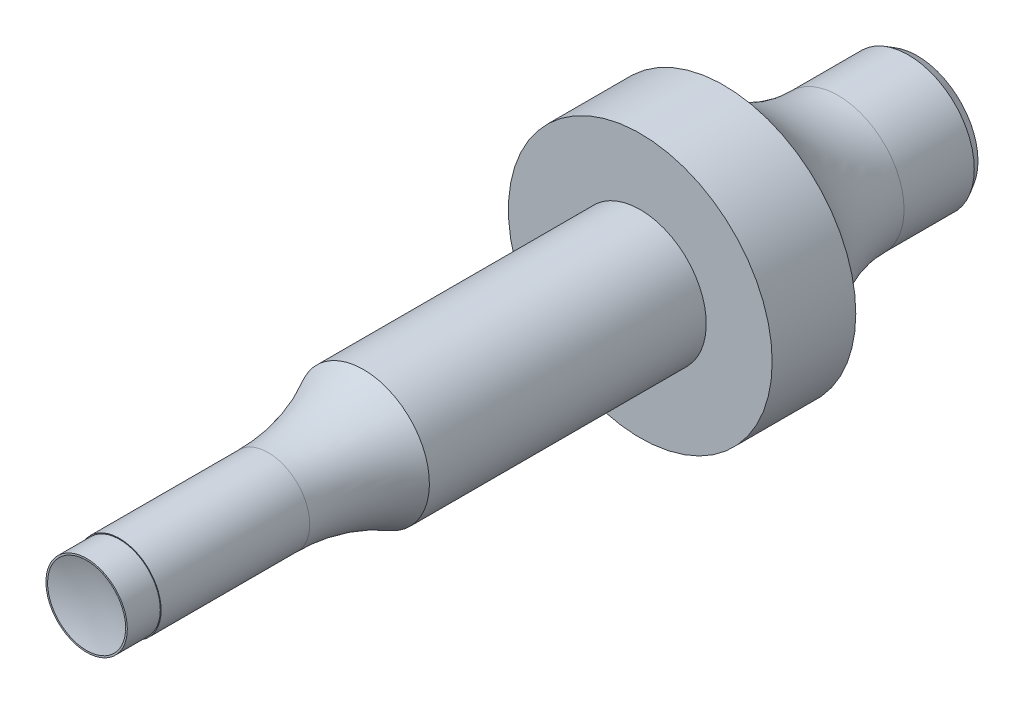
SolidWorks part; units mm, degrees
ref_plane "Front Plane" through (0, 0, 0) normal (0, 0, 1) x (1, 0, 0)
ref_plane "Top Plane" through (0, 0, 0) normal (0, 1, 0) x (1, 0, 0)
ref_plane "Right Plane" through (0, 0, 0) normal (1, 0, 0) x (0, 0, -1)
sketch "Sketch1" plane through (0, 0, 0) normal (0, 0, 1) x (1, 0, 0)
  circle A0 centre (0, 0) radius 7.94
  dimension "D1" = 15.88
extrude "Boss-Extrude1" add sketch "Sketch1" against normal blind 100
sketch "Sketch2" plane through (0, 0, 0) normal (0, 0, 1) x (1, 0, 0)
  circle A0 centre (0, 0) radius 5
  dimension "D1" = 10
extrude "Cut-Extrude1" cut sketch "Sketch2" against normal blind 33.3333 flip side to cut
sketch "Sketch3" plane through (0, 0, 0) normal (0, 0, 1) x (1, 0, 0)
  circle A0 centre (0, 0) radius 4.9
  dimension "D1" = 9.8
extrude "Cut-Extrude2" cut sketch "Sketch3" against normal blind 3.97 flip side to cut
sketch "Sketch4" plane through (0, 0, 0) normal (1, 0, 0) x (0, 0, -1)
  line L0 (0, 0) -> (0, 4.7)
  line L1 (0, 4.9) -> (0, -4.9) construction
  line L2 (0.7115, 0) -> (0.7115, 4.7) construction
  line L3 (0, 0) -> (0.7115, 0)
  line L4 (0, 0) -> (0, -4.7) construction
  arc A0 (0.7115, 0) -> (0, 4.7) centre (-15.1685, 0) ccw
  dimension "D2" = 15.88
  dimension "D1" = 9.4
revolve "Cut-Revolve1" cut sketch "Sketch4" angle 360 about L3
chamfer "Chamfer1" distance 1.0587 angle 30 1 edges at (7.94, 0, -100)
sketch "Sketch5" plane through (0, 0, 0) normal (1, 0, 0) x (0, 0, -1)
  line L0 (33.3333, 0) -> (21.8696, 0)
  line L1 (33.3333, 7.94) -> (33.3333, -7.94) construction
  line L2 (21.8696, 0) -> (21.8696, 5)
  line L3 (33.3333, 5) -> (3.97, 5) construction
  line L4 (33.3333, 7.94) -> (33.3333, 0)
  line L5 (21.8696, 5) -> (33.3333, 5) construction
  arc A0 (21.8696, 5) -> (33.3333, 7.94) centre (21.8696, 28.82) ccw
  dimension "D1" = 23.82
revolve "Revolve1" add sketch "Sketch5" angle 360 about L0
sketch "Sketch6" plane through (0, 0, 0) normal (1, 0, 0) x (0, 0, -1)
  line L0 (66.6667, 0) -> (90.4867, 0)
  line L1 (66.6667, 0) -> (66.6667, 15.88)
  line L2 (66.6667, 15.88) -> (76.7342, 15.88)
  line L3 (90.4867, 0) -> (90.4867, 7.94)
  line L4 (98.9413, 7.94) -> (33.3333, 7.94) construction
  line L5 (90.4867, 7.94) -> (66.6667, 7.94) construction
  line L6 (100, -7.94) -> (100, 7.94) construction
  arc A0 (90.4867, 7.94) -> (76.7342, 15.88) centre (90.4867, 23.82) cw
  dimension "D2" = 15.88
  dimension "D1" = 33.3333
  dimension "D3" = 23.82
revolve "Revolve2" add sketch "Sketch6" angle 360 about L0
sketch "Sketch7" plane through (0, 0, -100) normal (0, 0, -1) x (-1, 0, 0)
  line L9 (-13.4386, 3.0549) -> (-7.3288, 3.0549)
  line L10 (-13.4386, 3.0549) -> (-13.4386, -3.0549)
  line L11 (-13.4386, -3.0549) -> (-7.3288, -3.0549)
  line L12 (-7.3288, 3.0549) -> (-7.3288, -3.0549)
  circle A5 centre (0, 0) radius 7.94 construction
  circle A6 centre (0, 0) radius 7.3288 construction
  point P8 (-7.3288, 0)
extrude "Cut-Extrude3" [suppressed] cut sketch "Sketch7" against normal through all
